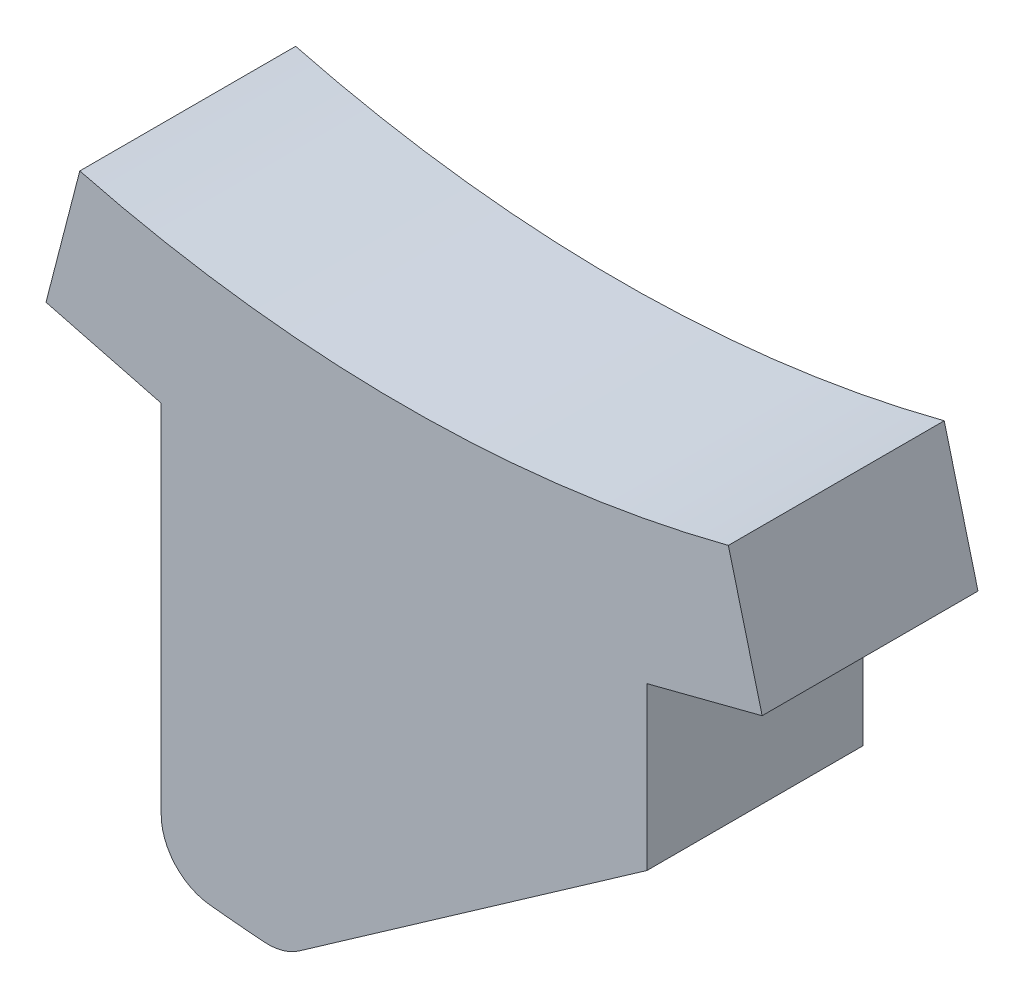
SolidWorks part; units mm, degrees
ref_plane "Front" through (0, 0, 0) normal (0, 0, 1) x (1, 0, 0)
ref_plane "Top" through (0, 0, 0) normal (0, 1, 0) x (1, 0, 0)
ref_plane "Right" through (0, 0, 0) normal (1, 0, 0) x (0, 0, -1)
sketch "Sketch1" plane through (0, 0, 0) normal (0, 0, 1) x (1, 0, 0)
  line L0 (-38.1579, 4.8543) -> (-42.1327, -10.515)
  line L1 (-42.1327, -10.515) -> (-28.575, -14.0213)
  line L2 (-28.575, -14.0213) -> (-28.575, -61.6007)
  line L4 (-14.2128, -63.0317) -> (28.575, -33.0713)
  line L5 (28.575, -33.0713) -> (28.575, -14.0213)
  line L6 (28.575, -14.0213) -> (42.1327, -10.515)
  line L7 (38.1579, 4.8543) -> (42.1327, -10.515)
  line L8 (0, 152.4) -> (0, 0) construction
  arc A0 (-38.1579, 4.8543) -> (38.1579, 4.8543) centre (0, 152.4) ccw
  arc A1 (-28.575, -61.6007) -> (-14.2128, -63.0317) centre (0, 152.4) ccw
  dimension "D1" = 304.8
  dimension "D5" = 215.9
  dimension "D2" = 29
  dimension "D3" = 15.875
  dimension "D4" = 55
  dimension "D6" = 57.15
  dimension "D7" = 19.05
extrude "Base-Extrude" add sketch "Sketch1" along normal mid plane 25.4
fillet "Fillet1" radius 6.35 2 edges at (-14.2128, -63.0317, 0) (-28.575, -61.6007, 0)
